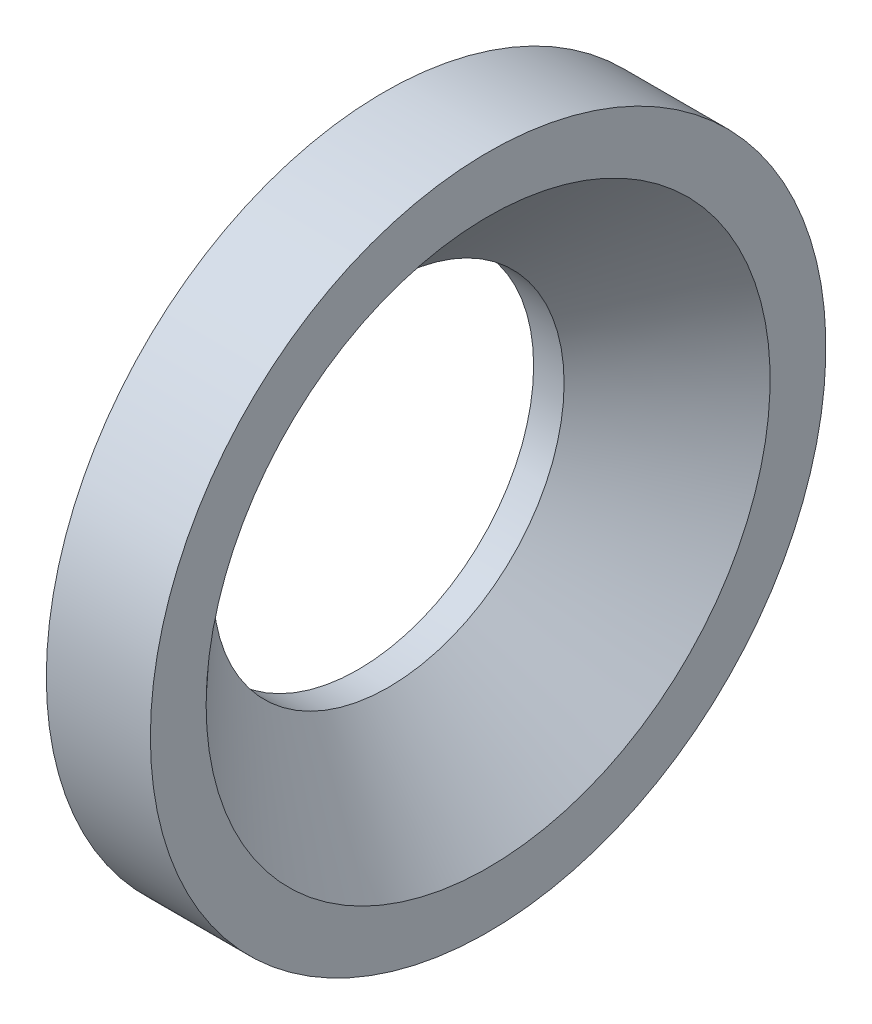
SolidWorks part; units mm, degrees
ref_plane "Front" through (0, 0, 0) normal (0, 0, 1) x (1, 0, 0)
ref_plane "Top" through (0, 0, 0) normal (0, 1, 0) x (1, 0, 0)
ref_plane "Right" through (0, 0, 0) normal (1, 0, 0) x (0, 0, -1)
sketch "Sketch1" plane through (0, 0, 0) normal (0, 0, 1) x (1, 0, 0)
  line L0 (-37.9925, 0) -> (79.6807, 0) construction
  line L2 (0, 15) -> (2.6035, 15)
  line L3 (2.6035, 15) -> (11.1125, 24.0919)
  line L4 (11.1125, 24.0919) -> (11.1125, 28.8544)
  line L5 (11.1125, 28.8544) -> (2.2225, 28.8544)
  line L6 (2.2225, 28.8544) -> (0, 18.81)
  line L8 (0, 15) -> (0, 18.81)
  dimension "D1" = 57.7088
  dimension "D7" = 3.81
  dimension "D4" = 8.509
  dimension "D2" = 4.7625
  dimension "D3" = 30
  dimension "D5" = 11.1125
  dimension "D6" = 8.89
revolve "Revolve1" add sketch "Sketch1" angle 360 about L0
sketch "Sketch2" plane through (0, 0, 0) normal (-1, 0, 0) x (0, 0, 1)
  circle A0 centre (0, 0) radius 15.748
  dimension "D1" = 31.496
sketch "Sketch3" plane through (11.1125, 0, 0) normal (1, 0, 0) x (0, 0, -1)
  line L0 (-32.3401, 0) -> (31.4219, 0)
sketch "Sketch4" [suppressed] plane through (0, 0, 0) normal (-1, 0, 0) x (0, 0, 1)
  line L0 (31.2179, 0) -> (-30.9118, 0)
sketch "Sketch5" [suppressed] plane through (0, 0, 0) normal (-1, 0, 0) x (0, 0, 1)
  line L0 (32.2381, 0) -> (-34.2785, 0)
sketch "Sketch6" [suppressed] plane through (0, 0, 0) normal (-1, 0, 0) x (0, 0, 1)
  circle A0 centre (0, 19.05) radius 3.175
  dimension "D1" = 6.35
  dimension "D2" = 19.05
extrude "Cut-Extrude1" [suppressed] cut sketch "Sketch6" against normal through all
pattern_circular "CirPattern1" [suppressed] count 12 over 360 about axis through (-37.9925, 0, 0) along (1, 0, 0)
